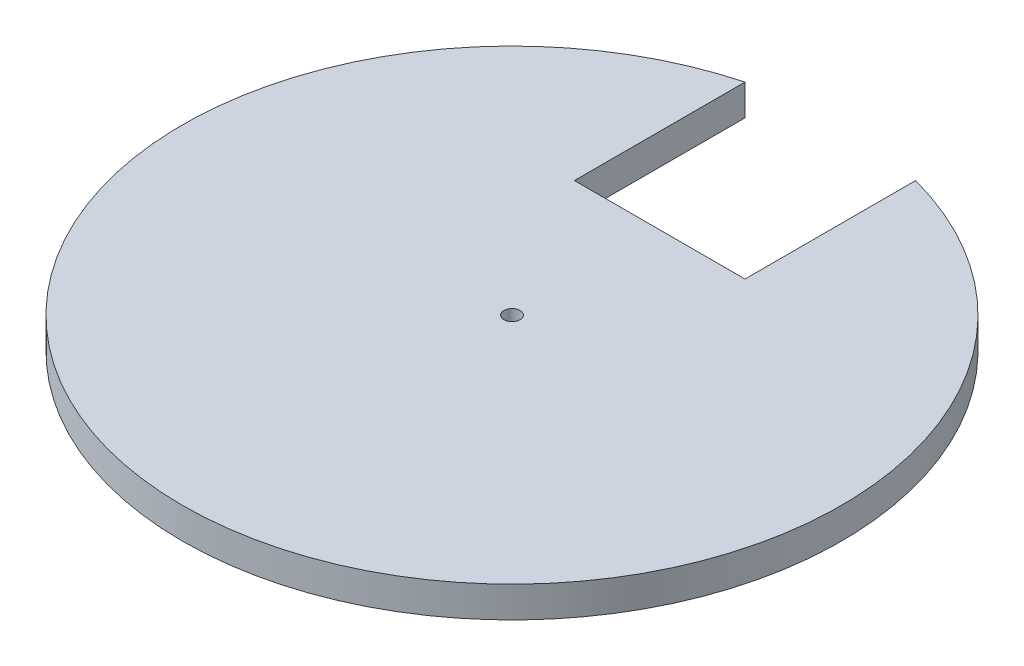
SolidWorks part; units mm, degrees
ref_plane "Front Plane" through (0, 0, 0) normal (0, 0, 1) x (1, 0, 0)
ref_plane "Top Plane" through (0, 0, 0) normal (0, 1, 0) x (1, 0, 0)
ref_plane "Right Plane" through (0, 0, 0) normal (1, 0, 0) x (0, 0, -1)
sketch "Sketch2" plane through (0, 0, 0) normal (0, 1, 0) x (1, 0, 0)
  line L0 (0, 0) -> (55, 0)
  line L1 (55, 0) -> (55, 55)
  line L3 (0, 55) -> (0, 0)
  arc A0 (0, 55) -> (55, 55) centre (27.5, -47.6314) ccw
extrude "Boss-Extrude1" add sketch "Sketch2" along normal blind 10
sketch "Sketch3" plane through (0, 10, 0) normal (0, 1, 0) x (1, 0, 0)
  circle A0 centre (27.5, -47.6314) radius 2.6
extrude "Cut-Extrude1" cut sketch "Sketch3" against normal blind 10
